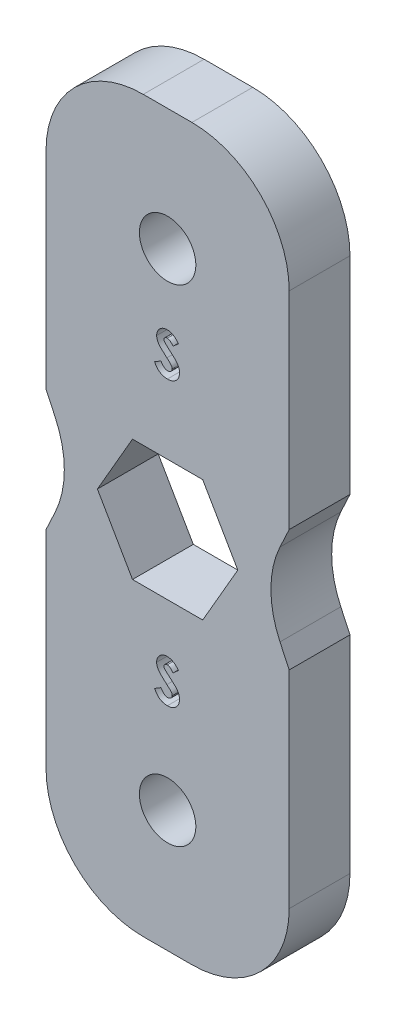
SolidWorks part; units mm, degrees
ref_plane "Front Plane" through (0, 0, 0) normal (0, 0, 1) x (1, 0, 0)
ref_plane "Top Plane" through (0, 0, 0) normal (0, 1, 0) x (1, 0, 0)
ref_plane "Right Plane" through (0, 0, 0) normal (1, 0, 0) x (0, 0, -1)
sketch "Sketch1" plane through (0, 0, 0) normal (0, 0, 1) x (1, 0, 0)
  line L1 (0, 38.1) -> (0, 22.225)
  line L3 (0, 38.1) -> (12.7, 38.1)
  line L4 (12.7, 0) -> (0, 0)
  line L5 (8.1831, 22.225) -> (4.5169, 22.225)
  line L6 (4.5169, 22.225) -> (2.6838, 19.05)
  line L7 (2.6838, 19.05) -> (4.5169, 15.875)
  line L8 (4.5169, 15.875) -> (8.1831, 15.875)
  line L9 (8.1831, 15.875) -> (10.0162, 19.05)
  line L10 (10.0162, 19.05) -> (8.1831, 22.225)
  line L11 (0, 22.225) -> (1.4799, 19.05)
  line L12 (1.4799, 19.05) -> (0, 15.875)
  line L13 (0, 15.875) -> (0, 0)
  line L14 (6.35, 38.1) -> (6.35, 0) construction
  line L15 (12.7, 15.875) -> (12.7, 0)
  line L16 (11.2201, 19.05) -> (12.7, 15.875)
  line L17 (12.7, 22.225) -> (11.2201, 19.05)
  line L18 (12.7, 38.1) -> (12.7, 22.225)
  circle A2 centre (6.35, 19.05) radius 3.175 construction
  point P7 (6.35, 38.1)
  dimension "D1" = 2.6838
  dimension "D7" = 6.35
  dimension "D3" = 12.7
  dimension "D5" = 19.05
extrude "Boss-Extrude1" add sketch "Sketch1" along normal blind 3.175
fillet "Fillet1" radius 5.08 6 edges at (1.4799, 19.05, 1.5875) (0, 0, 1.5875) (0, 38.1, 1.5875) (12.7, 0, 1.5875) (11.2201, 19.05, 1.5875) (12.7, 38.1, 1.5875)
hole_wizard "#4 Clearance Hole1" positions "Sketch3" profile "Sketch2" hole size "#4" standard "ANSI Inch"
sketch "Sketch3" plane through (0, 0, 0) normal (0, 0, -1) x (-1, 0, 0)
  line L11 (-12.7, 0) -> (0, 0)
  line L13 (0, 38.1) -> (-12.7, 38.1)
  line L15 (-12.7, 0) -> (0, 0)
  line L17 (0, 38.1) -> (-12.7, 38.1)
  line L30 (-8.1831, 15.875) -> (-4.5169, 15.875)
  line L31 (-10.0162, 19.05) -> (-8.1831, 15.875)
  line L32 (-8.1831, 22.225) -> (-10.0162, 19.05)
  line L33 (-4.5169, 22.225) -> (-8.1831, 22.225)
  line L34 (-2.6838, 19.05) -> (-4.5169, 22.225)
  line L35 (-4.5169, 15.875) -> (-2.6838, 19.05)
  line L36 (-8.1831, 15.875) -> (-4.5169, 15.875)
  line L37 (-10.0162, 19.05) -> (-8.1831, 15.875)
  line L38 (-8.1831, 22.225) -> (-10.0162, 19.05)
  line L39 (-4.5169, 22.225) -> (-8.1831, 22.225)
  line L40 (-2.6838, 19.05) -> (-4.5169, 22.225)
  line L41 (-4.5169, 15.875) -> (-2.6838, 19.05)
  line L79 (0, 0) -> (0, 15.875)
  line L80 (0, 0) -> (0, 15.875)
  line L81 (0, 15.875) -> (-1.4799, 19.05)
  line L82 (0, 15.875) -> (-1.4799, 19.05)
  line L83 (-1.4799, 19.05) -> (0, 22.225)
  line L84 (-1.4799, 19.05) -> (0, 22.225)
  line L85 (0, 22.225) -> (0, 38.1)
  line L86 (0, 22.225) -> (0, 38.1)
  line L97 (-12.7, 38.1) -> (-12.7, 22.225)
  line L98 (-12.7, 38.1) -> (-12.7, 22.225)
  line L99 (-12.7, 22.225) -> (-11.2201, 19.05)
  line L100 (-12.7, 22.225) -> (-11.2201, 19.05)
  line L101 (-11.2201, 19.05) -> (-12.7, 15.875)
  line L102 (-11.2201, 19.05) -> (-12.7, 15.875)
  line L103 (-12.7, 15.875) -> (-12.7, 0)
  line L104 (-12.7, 15.875) -> (-12.7, 0)
  point P0 (-6.35, 6.35)
  point P2 (-6.35, 31.75)
  dimension "D1" = 12.7
  dimension "D2" = 12.7
  dimension "D5" = 6.35
  dimension "D6" = 6.35
  dimension "D3" = 0
  dimension "D4" = 0
sketch "Sketch2" plane through (6.35, 6.35, 0) normal (1, 0, 0) x (0, 1, 0)
  line L0 (0, 0) -> (0, 3.175)
  line L1 (0, 3.175) -> (1.4732, 3.175)
  line L2 (1.4732, 3.175) -> (1.4732, 0)
  line L5 (1.4732, 0) -> (0, 0)
  line L11 (0, -6.35) -> (0, 107.95) construction
  dimension "Thru Hole Dia." = 2.9464
  dimension "Thru Hole Depth" = 3.175
sketch "Sketch4" plane through (0, 0, 3.175) normal (0, 0, 1) x (1, 0, 0)
  text T0 "<b>S</b>" font "Century Gothic" height in points 8
  text T1 "<b>S</b>" font "Century Gothic" height in points 8
  dimension "D1" = 0.762
extrude "Cut-Extrude1" cut sketch "Sketch4" against normal through all
sketch "Sketch5" plane through (0, 0, 0) normal (0, 0, 1) x (1, 0, 0)
  line L0 (11.0269, 28.6601) -> (11.0269, 9.4399)
  arc A0 (11.0269, 28.6601) -> (11.0269, 9.4399) centre (4.9334, 19.05) cw
  point P2 (11.0269, 19.05)
extrude "Boss-Extrude2" [suppressed] add sketch "Sketch5" along normal blind 3.175
